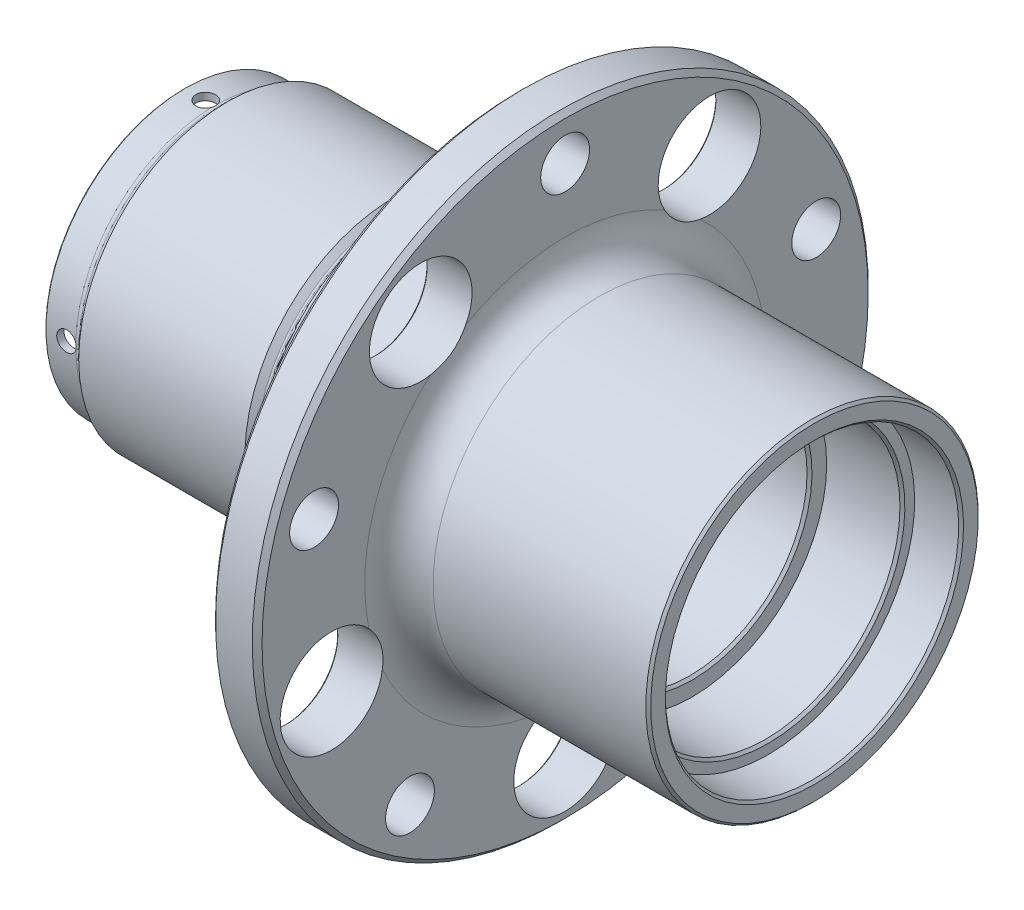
SolidWorks part; units mm, degrees
ref_plane "Front Plane" through (0, 0, 0) normal (0, 0, 1) x (1, 0, 0)
ref_plane "Top Plane" through (0, 0, 0) normal (0, 1, 0) x (1, 0, 0)
ref_plane "Right Plane" through (0, 0, 0) normal (1, 0, 0) x (0, 0, -1)
sketch "Sketch1" plane through (0, 0, 0) normal (0, 0, 1) x (1, 0, 0)
  line L0 (-110.959, 0) -> (217.3307, 0) construction
  line L1 (0, 144.7392) -> (0, -162.9319) construction
  line L2 (170.6667, 359) -> (853.3333, 359) construction
  line L3 (837.9112, 151.8388) -> (837.9112, 101.5388) construction
  line L4 (85.2171, 62.117) -> (85.2171, 46.117) construction
  line L5 (111.7869, 27.5) -> (111.7869, -27.5) construction
  line L6 (53.1859, 21) -> (53.1859, -21) construction
  line L7 (123.623, 30) -> (123.623, -30) construction
  line L8 (58.2844, 60.127) -> (58.2844, 48.127) construction
  line L9 (-136, 54) -> (-136, 0) construction
  line L10 (-136, 0) -> (-106.4638, 40.6531) construction
  line L11 (18.2578, -24.2605) -> (27.7578, -24.2605) construction
  line L12 (23.0078, -24.2605) -> (23.0078, -19.8539) construction
  circle A0 centre (-136, 0) radius 63
  circle A1 centre (-136, 0) radius 37.5
  circle A2 centre (-136, 0) radius 54
  circle A3 centre (-136, 54) radius 5.75
  circle A4 centre (-136, 0) radius 50.25
  circle A5 centre (-106.4638, 40.6531) radius 10.5
  point P18 (123.623, 0)
  point P29 (53.1859, 0)
  point P30 (111.7869, 0)
  dimension "D2" = 126
  dimension "D3" = 75
  dimension "D7" = 11.5
  dimension "D10" = 108
  dimension "D12" = 21
  dimension "D11" = 100.5
  dimension "D1" = 16
  dimension "D4" = 42
  dimension "D5" = 55
  dimension "D6" = 60
  dimension "D8" = 12
  dimension "D9" = 136
  dimension "D13" = 36
  dimension "D14" = 9.5
sketch "Sketch2" plane through (0, 0, 0) normal (0, 0, 1) x (1, 0, 0)
  line L0 (0, 0) -> (147.462, 0) construction
  line L1 (-110.959, 0) -> (217.3307, 0) construction
  line L2 (0, 28.5) -> (7, 28.5)
  line L3 (0, 144.7392) -> (0, -162.9319) construction
  line L4 (7, 28.5) -> (9, 30.5)
  line L5 (9, 30.5) -> (43, 30.5)
  line L6 (43, 30.5) -> (44.25, 29.25)
  line L7 (44.25, 29.25) -> (46, 29.25)
  line L8 (46, 29.25) -> (46, 31.75)
  line L9 (46, 31.75) -> (68.5, 31.75)
  line L10 (68.5, 31.75) -> (68.5, 63)
  line L11 (68.5, 63) -> (78, 63)
  line L12 (78, 63) -> (78, 34)
  line L13 (78, 34) -> (129, 34)
  line L14 (129, 34) -> (129, 30)
  line L15 (129, 30) -> (119.5, 30)
  line L16 (119.5, 30) -> (119.5, 27.5)
  line L17 (119.5, 27.5) -> (104, 27.5)
  line L18 (104, 27.5) -> (104, 24)
  line L19 (104, 24) -> (63, 24)
  line L20 (63, 24) -> (63, 17.75)
  line L21 (63, 17.75) -> (59, 17.75)
  line L22 (59, 17.75) -> (59, 21)
  line L23 (59, 21) -> (48, 21)
  line L24 (48, 21) -> (46.5, 22.5)
  line L25 (46.5, 22.5) -> (7, 22.5)
  line L26 (7, 22.5) -> (7, 27)
  line L27 (7, 27) -> (0, 27)
  line L28 (0, 27) -> (0, 28.5)
  dimension "D1" = 55
  dimension "D2" = 42
  dimension "D3" = 35.5
  dimension "D4" = 45
  dimension "D5" = 54
  dimension "D6" = 57
  dimension "D7" = 61
  dimension "D8" = 48
  dimension "D9" = 60
  dimension "D10" = 68
  dimension "D11" = 126
  dimension "D12" = 63.5
  dimension "D13" = 7
  dimension "D14" = 7
  dimension "D15" = 135
  dimension "D16" = 2.5
  dimension "D17" = 34
  dimension "D18" = 46
  dimension "D19" = 9.5
  dimension "D20" = 68.5
  dimension "D21" = 129
  dimension "D22" = 39.5
  dimension "D23" = 59
  dimension "D24" = 4
  dimension "D25" = 9.5
  dimension "D26" = 25
revolve "Revolve1" add sketch "Sketch2" angle 360 about L0
fillet "Fillet1" radius 12 1 edges at (63, -24, 0)
fillet "Fillet2" radius 7 1 edges at (78, -34, 0)
fillet "Fillet3" radius 3 1 edges at (68.5, -31.75, 0)
fillet "Fillet4" radius 1 1 edges at (46, -31.75, 0)
fillet "Fillet5" radius 1.5 1 edges at (46, -29.25, 0)
fillet "Fillet6" radius 0.5 1 edges at (44.25, -29.25, 0)
fillet "Fillet7" radius 1.5 1 edges at (7, -28.5, 0)
fillet "Fillet8" radius 1 1 edges at (7, -27, 0)
chamfer "Chamfer1" distance 0.3 angle 45 2 edges at (0, -27, 0) (0, -28.5, 0)
chamfer "Chamfer2" distance 0.5 angle 45 6 edges at (129, -34, 0) (129, -30, 0) (119.5, -27.5, 0) (104, -24, 0) (59, -17.75, 0) (7, -22.5, 0)
chamfer "Chamfer3" distance 1 angle 45 2 edges at (68.5, -63, 0) (78, -63, 0)
sketch "Sketch3" plane through (68.5, 0, 0) normal (-1, 0, 0) x (0, 0, 1)
  line L0 (0, 54) -> (0, 0) construction
  line L1 (0, 0) -> (29.5362, 40.6531) construction
  circle A0 centre (0, 54) radius 5
  circle A1 centre (29.5362, 40.6531) radius 10.5
  circle A2 centre (0, 0) radius 50.25 construction
  dimension "D2" = 10
  dimension "D3" = 21
  dimension "D4" = 100.5
  dimension "D1" = 54
  dimension "D5" = 36
extrude "Cut-Extrude1" cut sketch "Sketch3" against normal blind 10
chamfer "Chamfer4" distance 0.3 angle 45 2 edges at (68.5, 30.1531, 29.5362) (68.5, 49, 0)
pattern_circular "CirPattern1" count 5 over 360 about axis through (0, 0, 0) along (1, 0, 0) of "Cut-Extrude1", "Chamfer4"
sketch "Sketch4" plane through (0, 0, 0) normal (0, 0, 1) x (1, 0, 0)
  line L0 (-110.959, 0) -> (217.3307, 0) construction
  circle A0 centre (4.5, 0) radius 2
  dimension "D1" = 4
  dimension "D2" = 4.5
extrude "Cut-Extrude2" cut sketch "Sketch4" against normal blind 41
pattern_circular "CirPattern2" count 4 over 360 about axis through (-110.959, 0, 0) along (1, 0, 0) of "Cut-Extrude2"
sketch "Sketch5" plane through (0, 0, 0) normal (0, 1, 0) x (1, 0, 0)
  line L0 (-110.959, 0) -> (217.3307, 0) construction
  circle A0 centre (23, 0) radius 4.75
  dimension "D1" = 9.5
  dimension "D2" = 23
extrude "Cut-Extrude3" cut sketch "Sketch5" against normal blind 35
